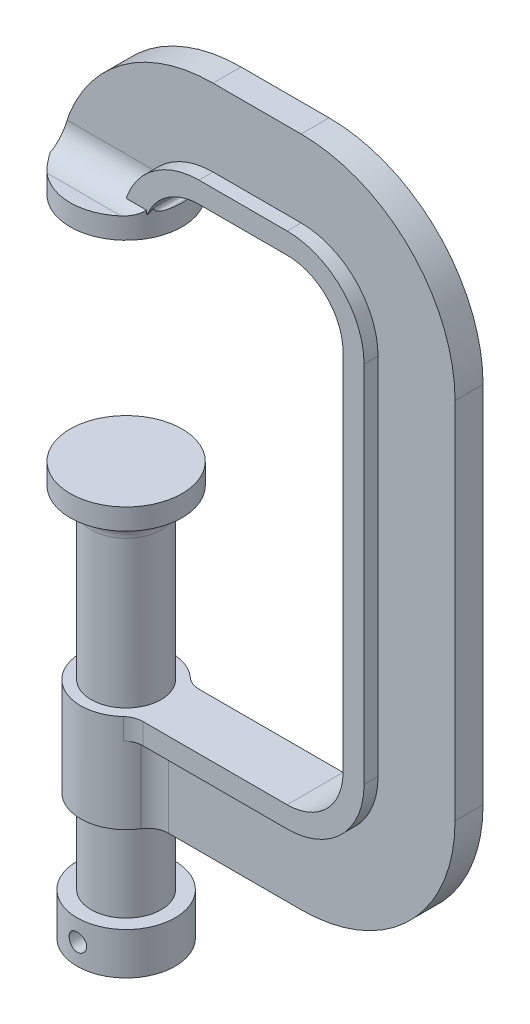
SolidWorks part; units mm, degrees
ref_plane "Front Plane" through (0, 0, 0) normal (0, 0, 1) x (1, 0, 0)
ref_plane "Top Plane" through (0, 0, 0) normal (0, 1, 0) x (1, 0, 0)
ref_plane "Right Plane" through (0, 0, 0) normal (1, 0, 0) x (0, 0, -1)
sketch "Sketch2" plane through (0, 0, 0) normal (0, 0, 1) x (1, 0, 0)
  line L0 (0, 14) -> (27, 14)
  line L1 (35, 22) -> (35, 74)
  line L2 (27, 82) -> (14.4162, 82)
  line L3 (-4.1329, 77) -> (2.1565, 77) construction
  arc A0 (35, 74) -> (27, 82) centre (27, 74) ccw
  arc A1 (35, 22) -> (27, 14) centre (27, 22) cw
  arc A2 (14.4162, 82) -> (7, 77) centre (14.4162, 74) ccw
  dimension "D1" = 8
  dimension "D2" = 8
  dimension "D3" = 8
  dimension "D4" = 35
  dimension "D5" = 14
  dimension "D6" = 63
  dimension "D7" = 5
  dimension "D8" = 7
sketch "Sketch4" plane through (0, 0, 0) normal (1, 0, 0) x (0, 0, -1)
  line L0 (-2, 0) -> (2, 0)
  line L1 (2, 0) -> (2, 11)
  line L2 (2, 11) -> (4, 11)
  line L3 (4, 11) -> (4, 14)
  line L4 (4, 14) -> (-4, 14)
  line L5 (-4, 14) -> (-4, 11)
  line L6 (-4, 11) -> (-2, 11)
  line L7 (-2, 11) -> (-2, 0)
  line L8 (0, -2.9648) -> (0, 19.8429) construction
  line L9 (0, 22) -> (0, 14) construction
  dimension "D1" = 4
  dimension "D2" = 8
  dimension "D3" = 3
sweep "Sweep1" add profiles "Sketch4" path "Sketch2"
sketch "Sketch5" plane through (0, 0, 0) normal (0, 1, 0) x (1, 0, 0)
  circle A0 centre (0, 0) radius 6.5
  dimension "D1" = 13
extrude "Extrude1" add sketch "Sketch5" along normal up to surface (14 mm away)
sketch "Sketch6" plane through (27.7522, 68.6053, 0) normal (-0.375, -0.927, 0) x (0.927, -0.375, 0)
  line L0 (-22.3858, 9.2349) -> (-22.3858, -7.8416) construction
  line L8 (-25.3858, 2) -> (-36.3858, 2)
  line L9 (-36.3858, 2) -> (-36.3858, -2)
  line L10 (-36.3858, -2) -> (-25.3858, -2)
  line L11 (-25.3858, -2) -> (-25.3858, -4)
  line L12 (-25.3858, -4) -> (-22.3858, -4)
  line L13 (-22.3858, -4) -> (-22.3858, 4)
  line L14 (-22.3858, 4) -> (-25.3858, 4)
  line L15 (-25.3858, 4) -> (-25.3858, 2)
  line L16 (-25.3858, 2) -> (-36.3858, 2)
  line L17 (-36.3858, 2) -> (-36.3858, -2)
  line L18 (-36.3858, -2) -> (-25.3858, -2)
  line L19 (-25.3858, -2) -> (-25.3858, -4)
  line L20 (-25.3858, -4) -> (-22.3858, -4)
  line L21 (-22.3858, -4) -> (-22.3858, 4)
  line L22 (-22.3858, 4) -> (-25.3858, 4)
  line L23 (-25.3858, 4) -> (-25.3858, 2)
  dimension "D1" = 0
revolve "Revolve1" add sketch "Sketch6" angle 22.024 about L0
ref_plane "Plane1" through (0, 74, 0) normal (0, 1, 0) x (-1, 0, 0)
sketch "Sketch8" plane through (0, 74, 0) normal (0, 1, 0) x (-1, 0, 0)
  circle A0 centre (0, 0) radius 8
  dimension "D1" = 16
extrude "Extrude2" add sketch "Sketch8" along normal up to surface (3 mm away)
fillet "Fillet1" radius 3 4 edges at (6.1847, 5.5, -2) (6.1847, 5.5, 2) (5.1235, 12.5, 4) (5.1235, 12.5, -4)
fillet "Fillet3" radius 4 9 edges at (4.0552, 77.5731, 2) (4.0552, 77.5731, -2) (4, 77, 3) (-1.5, 77, 2) (-1.5, 77, -2) (4, 77, -3) (5.4641, 77, -4) (5.4641, 77, 4) (-8, 77.0001, 0)
fillet "Fillet4" radius 1 5 edges at (-7, 77.0001, 0) (-8, 77.0001, 0) (-6.8746, 78.87, 2.6143)
fillet "Fillet5" radius 0.5 2 edges at (7, 77, 0) (8, 77, 0)
sketch "Sketch9" plane through (0, 0, 0) normal (0, 0, 1) x (1, 0, 0)
  line L0 (0, 51.9307) -> (0, -6.0298) construction
  line L1 (0, 41) -> (8, 41)
  line L2 (8, 41) -> (8, 38)
  line L3 (8, 38) -> (5, 38)
  line L4 (5, 38) -> (5, -12)
  line L5 (5, -12) -> (7, -12)
  line L6 (7, -12) -> (7, -18)
  line L7 (7, -18) -> (0, -18)
  line L8 (0, -18) -> (0, 41)
  line L9 (27, 14) -> (6.4226, 14) construction
  line L10 (27, 0) -> (8.0777, 0) construction
  dimension "D1" = 16
  dimension "D2" = 10
  dimension "D3" = 3
  dimension "D4" = 14
  dimension "D5" = 24
  dimension "D6" = 12
  dimension "D7" = 6
revolve "Revolve2" add sketch "Sketch9" angle 360 about L0
fillet "Fillet6" radius 3 1 edges at (0, 38, 5)
sketch "Sketch10" plane through (0, 0, 0) normal (0, 0, 1) x (1, 0, 0)
  line L5 (9.0437, -15) -> (-9.6099, -15) construction
  circle A0 centre (0, -15) radius 1.25
  dimension "D1" = 2.5
extrude "Cut-Extrude1" cut sketch "Sketch10" against normal through all and the other way through all
